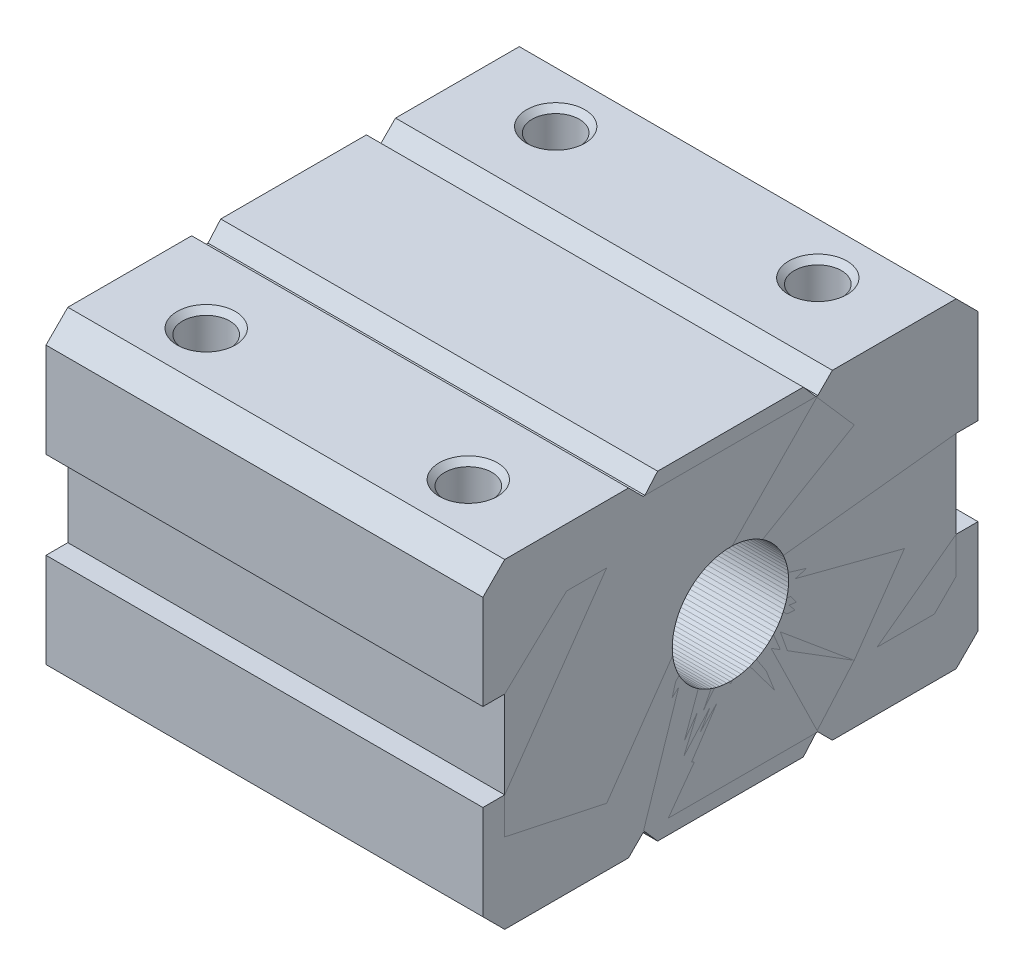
SolidWorks part; units mm, degrees
other "Solid2"
ref_plane "Front Plane" through (0, 0, 0) normal (0, 0, 1) x (1, 0, 0)
ref_plane "Top Plane" through (0, 0, 0) normal (0, 1, 0) x (1, 0, 0)
ref_plane "Right Plane" through (0, 0, 0) normal (1, 0, 0) x (0, 0, -1)
imported_body "2.7088 SCE8UU.stp<1>"
move or copy body "Body-Move/Copy1" bodies to move or copy 101 copy no rotation origin (0, 11, 0) rotation axis (1, 0, 0) rotation angle 180
